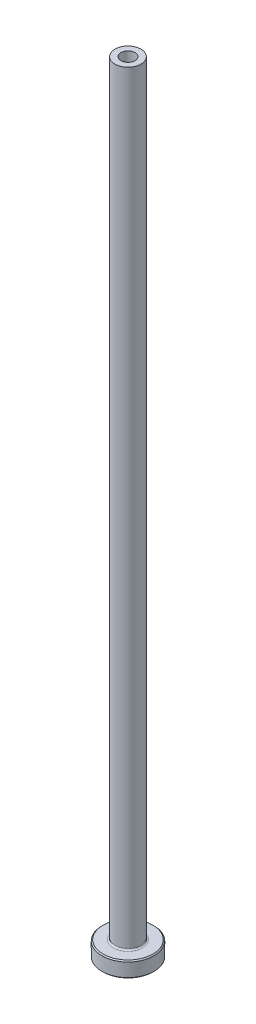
SolidWorks part; units mm, degrees
ref_plane "Front Plane" through (0, 0, 0) normal (0, 0, 1) x (1, 0, 0)
ref_plane "Top Plane" through (0, 0, 0) normal (0, 1, 0) x (1, 0, 0)
ref_plane "Right Plane" through (0, 0, 0) normal (1, 0, 0) x (0, 0, -1)
sketch "Sketch1" plane through (0, 0, 0) normal (0, 0, 1) x (1, 0, 0)
  line L0 (-1.35, 150) -> (-2.5, 150)
  line L1 (-2.5, 150) -> (-2.5, 3)
  line L2 (-2.5, 3) -> (-5, 3)
  line L3 (-5, 3) -> (-5, 0)
  line L4 (5.5, 0) -> (-5.5, 0) construction
  line L5 (-5, 0) -> (-1.6, 0)
  line L6 (-1.35, 105) -> (-1.35, 150)
  line L7 (0, 92.1877) -> (0, -15.5353) construction
  line L8 (0, -5.5) -> (0, 5.5) construction
  line L9 (-1.35, 105) -> (-1.6, 93)
  line L10 (-1.6, 93) -> (-1.6, 0)
  dimension "D1" = 0.25
  dimension "ID" = 2.7
  dimension "OD" = 5
  dimension "L" = 150
  dimension "H" = 10
  dimension "T" = 3
  dimension "N" = 45
  dimension "D2" = 12
revolve "Revolve1" add sketch "Sketch1" angle 360 about L7
fillet "Fillet1" radius 0.3 1 edges at (0, 3, 2.5)
chamfer "Chamfer1" distance 0.2 angle 45 2 edges at (0, 3, 5) (0, 0, 5)
chamfer "Chamfer3" distance 0.5 angle 45 1 edges at (0, 0, 1.6)
